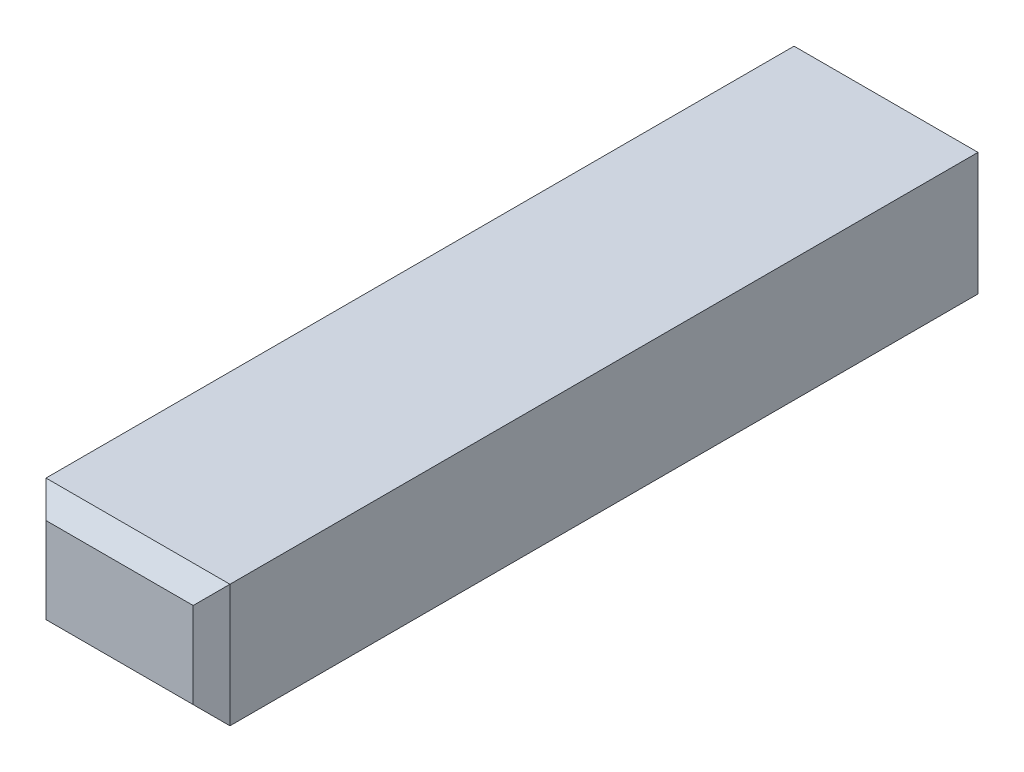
SolidWorks part; units mm, degrees
ref_plane "Front Plane" through (0, 0, 0) normal (0, 0, 1) x (1, 0, 0)
ref_plane "Top Plane" through (0, 0, 0) normal (0, 1, 0) x (1, 0, 0)
ref_plane "Right Plane" through (0, 0, 0) normal (1, 0, 0) x (0, 0, -1)
sketch "Sketch1" plane through (0, 0, 0) normal (0, 0, 1) x (1, 0, 0)
  line L1 (-6, -4) -> (6, -4)
  line L2 (-6, -4) -> (-6, 4)
  line L3 (-6, 4) -> (6, 4)
  line L4 (6, -4) -> (6, 4)
  line L5 (-6, -4) -> (6, 4) construction
  line L6 (-6, 4) -> (6, -4) construction
  point P0 (0, 0)
  dimension "D1" = 12
  dimension "D2" = 8
extrude "Boss-Extrude1" add sketch "Sketch1" along normal mid plane 50
chamfer "Chamfer1" distance 1.2 angle 45 4 edges at (0, -4, 25) (-6, 0, 25) (0, 4, 25) (6, 0, 25)
